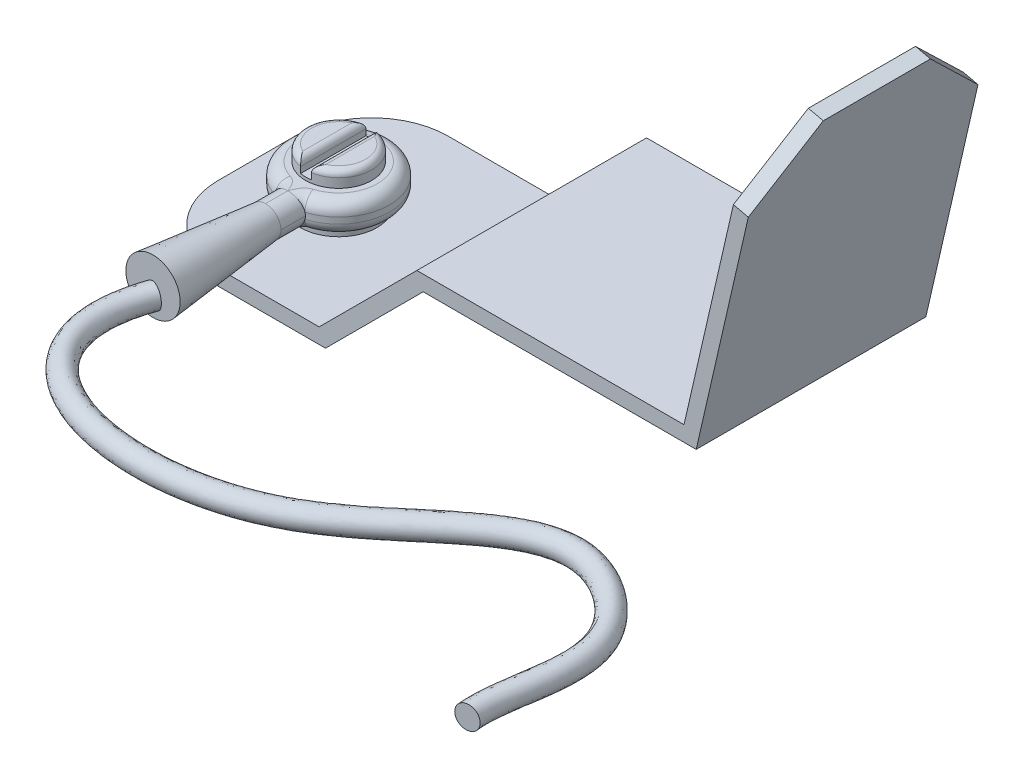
SolidWorks part; units mm, degrees
ref_plane "Front Plane" through (0, 0, 0) normal (0, 0, 1) x (1, 0, 0)
ref_plane "Top Plane" through (0, 0, 0) normal (0, 1, 0) x (1, 0, 0)
ref_plane "Right Plane" through (0, 0, 0) normal (1, 0, 0) x (0, 0, -1)
sketch "Sketch1" plane through (0, 0, 0) normal (0, 0, 1) x (1, 0, 0)
  line L0 (-18.1019, -12.5582) -> (-6.1083, -12.5582)
  line L1 (-6.1083, -12.5582) -> (0.2725, -6.1775)
  line L2 (0.2725, -6.1775) -> (11.1807, -6.1775)
  line L3 (11.1807, -6.1775) -> (18.1019, -6.1775)
  line L4 (-18.1019, -11.5582) -> (-6.5225, -11.5582)
  line L5 (18.1019, -6.1775) -> (22.3998, 12.5582)
  line L6 (-6.5225, -11.5582) -> (-0.1417, -5.1775)
  line L7 (-0.1417, -5.1775) -> (11.1807, -5.1775)
  line L8 (11.1807, -5.1775) -> (17.3053, -5.1775)
  line L9 (17.3053, -5.1775) -> (21.4251, 12.7818)
  line L10 (22.3998, 12.5582) -> (21.4251, 12.7818)
  line L11 (-18.1019, -11.5582) -> (-6.1083, -11.5582) construction
  line L12 (-6.8154, -11.8511) -> (-0.1417, -5.1775) construction
  line L13 (-18.1019, -12.5582) -> (-18.1019, -11.5582)
  dimension "D1" = 1
  dimension "D2" = 1
extrude "Boss-Extrude1" add sketch "Sketch1" along normal blind 15
chamfer "Chamfer1" distance 4 angle 45 2 edges at (21.9124, 12.67, 0) (21.9124, 12.67, 15)
fillet "Fillet1" radius 5 2 edges at (-18.1019, -12.0582, 0) (-18.1019, -12.0582, 15)
sketch "Sketch2" plane through (0, -11.5582, 0) normal (0, 1, 0) x (1, 0, 0)
  circle A0 centre (-12.7462, -7.5) radius 2.5
extrude "Boss-Extrude2" add sketch "Sketch2" along normal blind 0.5
sketch "Sketch3" plane through (0, -11.0582, 0) normal (0, 1, 0) x (1, 0, 0)
  line L0 (-11.7462, -19.6271) -> (-13.7462, -19.6271)
  line L1 (-13.7462, -10.6744) -> (-13.7462, -19.6271)
  line L2 (-11.7462, -10.6744) -> (-11.7462, -19.6271)
  arc A0 (-11.7462, -10.6744) -> (-13.7462, -10.6744) centre (-12.7462, -7.5) ccw
extrude "Boss-Extrude3" add sketch "Sketch3" along normal blind 2
fillet "Fillet2" radius 1 4 edges at (-11.7462, -11.0582, 15.1508) (-13.7462, -11.0582, 15.1508) (-11.7462, -9.0582, 15.1508) (-13.7462, -9.0582, 15.1508)
fillet "Fillet3" radius 0.8 2 edges at (-12.7462, -11.0582, 10.8282) (-12.7462, -9.0582, 10.8282)
sketch "Sketch4" plane through (0, 0, 19.6271) normal (0, 0, 1) x (1, 0, 0)
  circle A0 centre (-12.7462, -10.0582) radius 1.7728
extrude "Boss-Extrude4" add sketch "Sketch4" against normal blind 12 draft 6
sketch "Sketch5" plane through (0, -9.0582, 0) normal (0, 1, 0) x (1, 0, 0)
  circle A0 centre (-12.7462, -7.5) radius 2.1628
extrude "Boss-Extrude5" add sketch "Sketch5" along normal blind 1
sketch "Sketch6" plane through (0, -8.0582, 0) normal (0, 1, 0) x (1, 0, 0)
  line L0 (-12.7462, -5.3372) -> (-12.7462, -9.6628) construction
  line L1 (-12.3927, -5.3372) -> (-12.3927, -9.6628)
  line L2 (-13.0998, -5.3372) -> (-13.0998, -9.6628)
  circle A0 centre (-12.7462, -7.5) radius 2.1628 construction
  arc A1 (-12.3927, -5.3372) -> (-13.0998, -5.3372) centre (-12.7462, -5.3372) ccw
  arc A2 (-13.0998, -9.6628) -> (-12.3927, -9.6628) centre (-12.7462, -9.6628) ccw
  point P4 (-12.7462, -7.5)
extrude "Cut-Extrude1" cut sketch "Sketch6" against normal blind 0.8
fillet "Fillet4" radius 0.4 4 edges at (-14.9091, -8.0582, 7.5) (-10.5834, -8.0582, 7.5) (-12.3927, -8.0582, 7.5) (-13.0998, -8.0582, 7.5)
ref_plane "Plane1" through (0, -10.0582, 0) normal (0, 1, 0) x (-1, 0, 0)
sketch "Sketch7" plane through (0, -10.0582, 0) normal (0, 1, 0) x (-1, 0, 0)
  spline S0 degree 3 poles (12.7462, 19.6271) (16.069, 29.0858) (-3.9038, 33.8512) (-13.8113, 17.3965) (-23.5602, 25.1519) (-21.0306, 30.727) (-21.3312, 33.3295) knots 0 0 0 0 0.438777 0.718444 0.835663 1 1 1 1
ref_plane "Plane2" through (-12.7462, -10.0582, 19.6271) normal (-0.3314, 0, 0.9435) x (0.9435, 0, 0.3314)
sketch "Sketch8" plane through (-12.7462, -10.0582, 19.6271) normal (-0.3314, 0, 0.9435) x (0.9435, 0, 0.3314)
  circle A0 centre (0.145, -0.4193) radius 0.75
  dimension "D1" = 1.5
sweep "Sweep1" add profiles "Sketch8" path "Sketch7"
